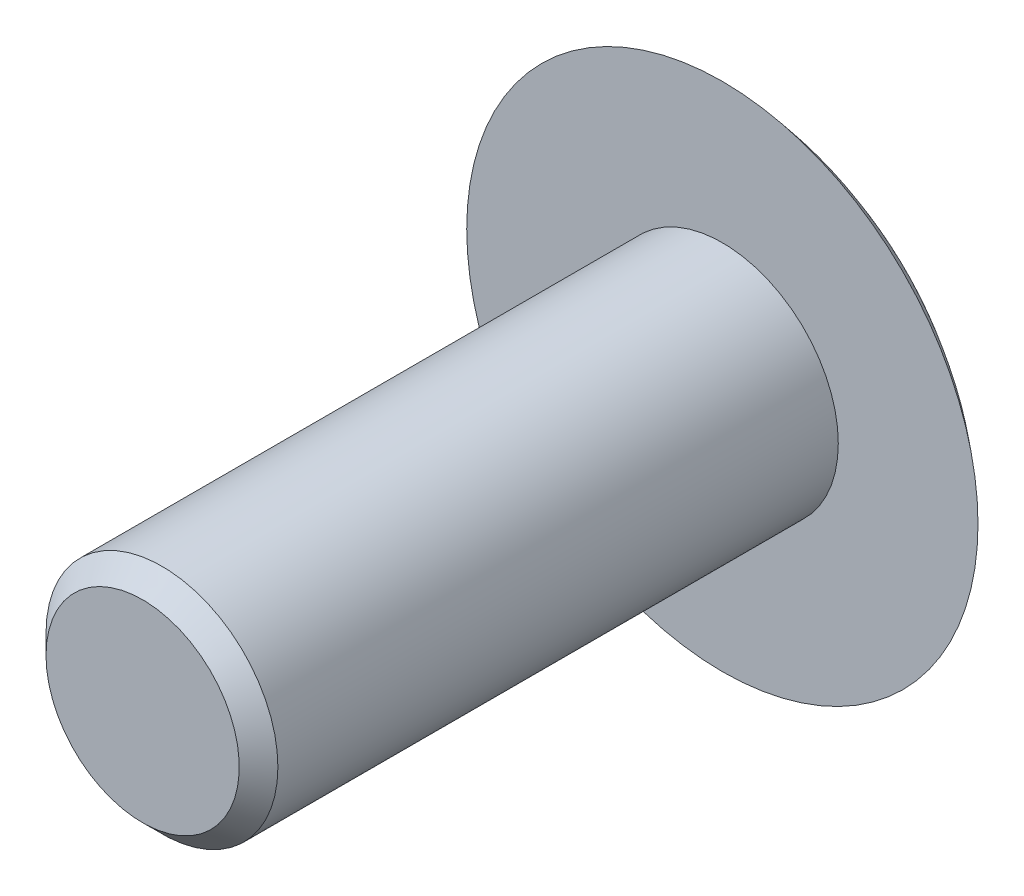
SolidWorks part; units mm, degrees
ref_plane "Face" through (0, 0, 0) normal (0, 0, 1) x (1, 0, 0)
ref_plane "Dessus" through (0, 0, 0) normal (0, 1, 0) x (1, 0, 0)
ref_plane "Droite" through (0, 0, 0) normal (1, 0, 0) x (0, 0, -1)
sketch "Esquisse1" plane through (0, 0, 0) normal (0, 1, 0) x (1, 0, 0)
  line L0 (0, 0) -> (0, 17.5)
  line L1 (-6.6144, 15) -> (-3, 15)
  line L2 (-3, 15) -> (-3, 0)
  line L3 (-3, 0) -> (0, 0)
  arc A0 (0, 17.5) -> (-6.6144, 15) centre (0, 7.5) ccw
  dimension "D3" = 10
  dimension "D4" = 7.5
  dimension "D1" = 3
  dimension "D2" = 15
revolve "Révolution1" add sketch "Esquisse1" angle 360 about L0
chamfer "Chanfrein1" distance 0.5 angle 45 1 edges at (3, 0, 0)
